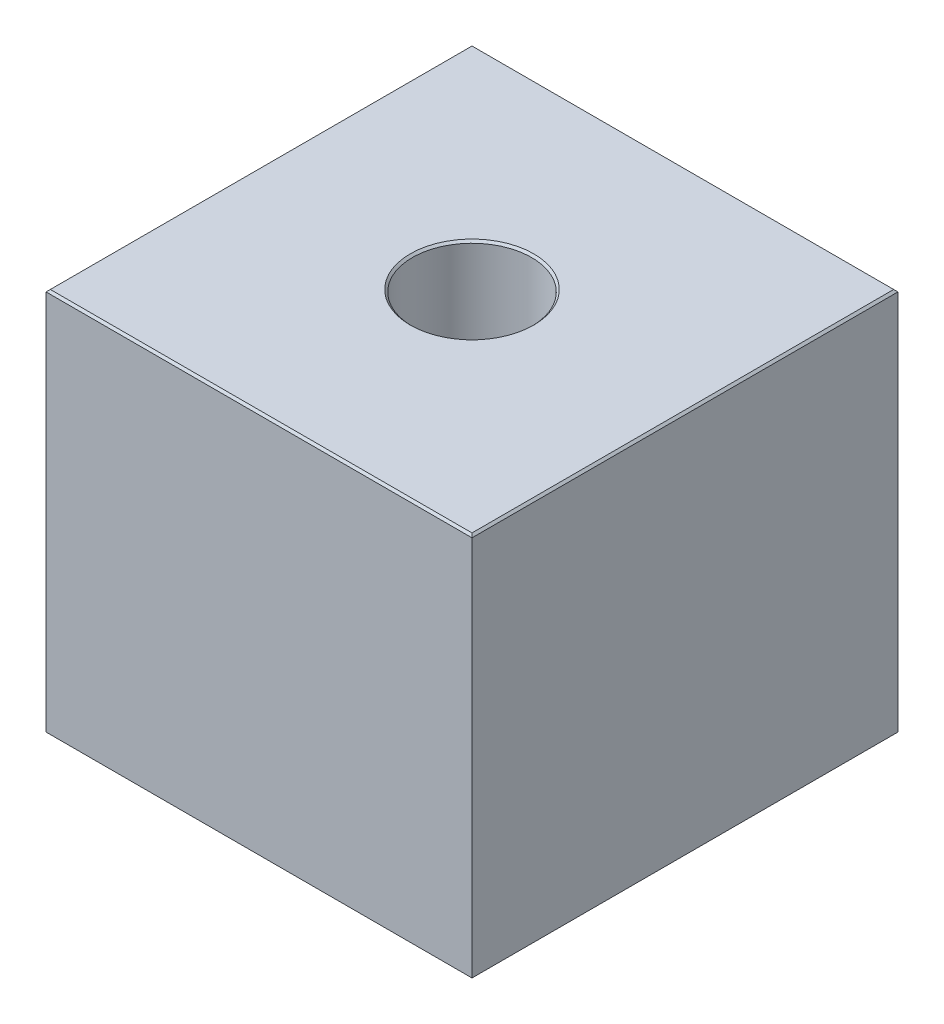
SolidWorks part; units mm, degrees
ref_plane "Face" through (0, 0, 0) normal (0, 0, 1) x (1, 0, 0)
ref_plane "Dessus" through (0, 0, 0) normal (0, 1, 0) x (1, 0, 0)
ref_plane "Droite" through (0, 0, 0) normal (1, 0, 0) x (0, 0, -1)
sketch "Esquisse1" plane through (0, 0, 0) normal (0, 0, 1) x (1, 0, 0)
  line L1 (0, 0) -> (100, 0)
  line L2 (0, 0) -> (0, 90)
  line L3 (0, 90) -> (100, 90)
  line L4 (100, 0) -> (100, 90)
  dimension "D1" = 90
  dimension "D2" = 100
extrude "Extrusion1" add sketch "Esquisse1" along normal blind 100
sketch "Esquisse2" plane through (0, 90, 0) normal (0, 1, 0) x (-1, 0, 0)
  line L0 (-100, 0) -> (0, 0) construction
  line L1 (0, 100) -> (0, 0) construction
  circle A0 centre (-50, 50) radius 14
  dimension "D1" = 28
  dimension "D2" = 50
  dimension "D3" = 50
extrude "Enlèv. mat.-Extru.1" cut sketch "Esquisse2" against normal through all
chamfer "Chanfrein3" distance 0.5 angle 45 5 edges at (100, 90, 50) (50, 90, 100) (0, 90, 50) (50, 90, 0) (50, 90, 64)
